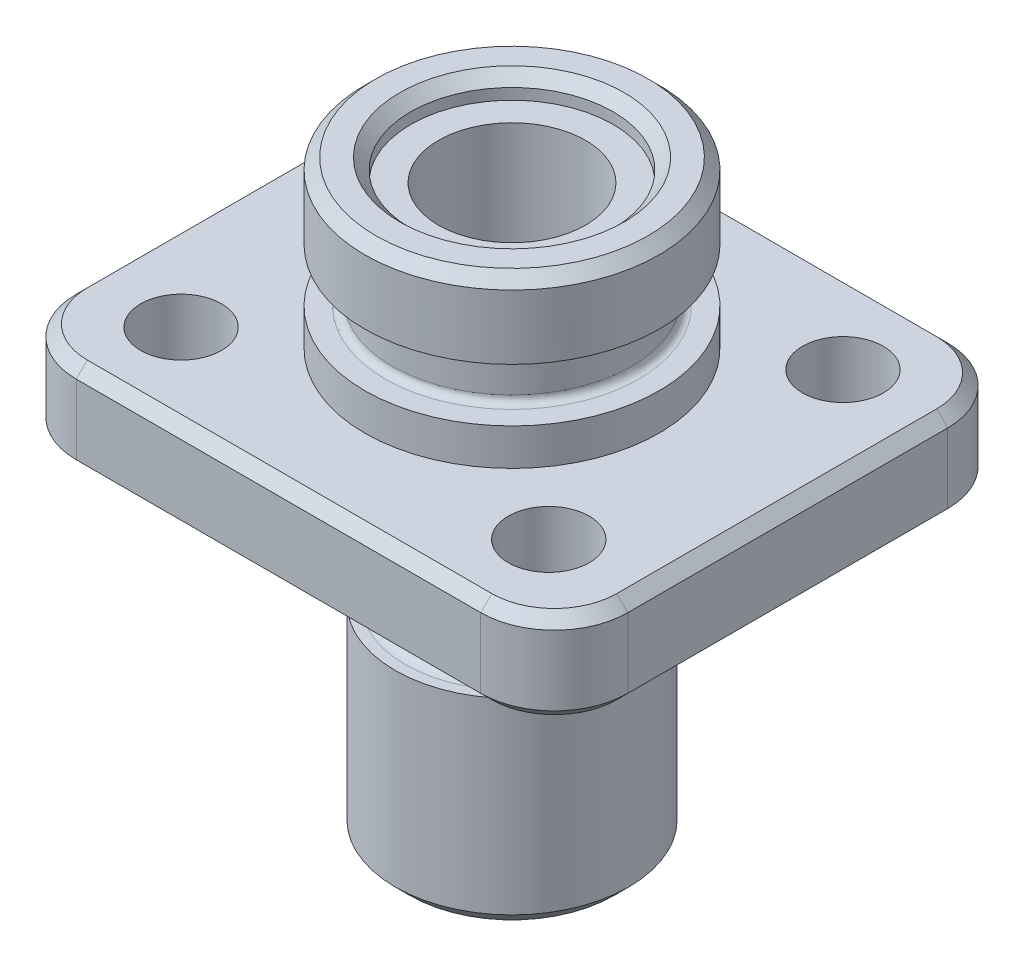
SolidWorks part; units mm, degrees
ref_plane "前视基准面" through (0, 0, 0) normal (0, 0, 1) x (1, 0, 0)
ref_plane "上视基准面" through (0, 0, 0) normal (0, 1, 0) x (1, 0, 0)
ref_plane "右视基准面" through (0, 0, 0) normal (1, 0, 0) x (0, 0, -1)
sketch "草图1" plane through (0, 0, 0) normal (0, 1, 0) x (1, 0, 0)
  line L1 (-7.5, -6.35) -> (7.5, -6.35)
  line L2 (-7.5, -6.35) -> (-7.5, 6.35)
  line L3 (-7.5, 6.35) -> (7.5, 6.35)
  line L4 (7.5, -6.35) -> (7.5, 6.35)
  line L5 (-7.5, -6.35) -> (7.5, 6.35) construction
  line L6 (-7.5, 6.35) -> (7.5, -6.35) construction
  point P0 (0, 0)
  dimension "D1" = 12.7
  dimension "D2" = 15
extrude "凸台-拉伸1" add sketch "草图1" along normal blind 4.5
sketch "草图3" plane through (0, 0, 0) normal (0, 0, 1) x (1, 0, 0)
  line L0 (0, 11.7015) -> (0, -15.4245) construction
  line L1 (0, 13) -> (-5.45, 13)
  line L2 (-5.45, 13) -> (-5.45, 4.5)
  line L3 (-7.5, 4.5) -> (7.5, 4.5) construction
  line L4 (-3.5, 4.5) -> (-3.5, -5)
  line L6 (-3.5, -5) -> (-2.9, -5)
  line L7 (-3.175, -6.5) -> (-3.175, -11.6)
  line L8 (-2.775, -12) -> (0, -12)
  line L9 (0, -12) -> (0, 13)
  line L10 (-5.45, 4.5) -> (-3.5, 4.5)
  line L11 (-3.175, -6.5) -> (-2.9, -6.5)
  line L12 (-2.6, -6.2) -> (-2.6, -5.3)
  line L13 (-7.5, 0) -> (7.5, 0) construction
  line L14 (-3.175, -11.6) -> (-2.775, -12)
  arc A0 (-2.9, -6.5) -> (-2.6, -6.2) centre (-2.9, -6.2) ccw
  arc A1 (-2.9, -5) -> (-2.6, -5.3) centre (-2.9, -5.3) cw
  point P12 (-3.175, -12)
  point P21 (-2.6, -6.5)
  point P24 (-2.6, -5)
  dimension "D9" = 0.3
  dimension "D1" = 10.9
  dimension "D2" = 8.5
  dimension "D3" = 1.5
  dimension "D4" = 6.35
  dimension "D5" = 7
  dimension "D6" = 5.2
  dimension "D7" = 5.5
  dimension "D8" = 12
revolve "旋转1" add sketch "草图3" angle 360 about L0
sketch "草图4" plane through (0, 0, 0) normal (1, 0, 0) x (0, 0, -1)
  line L0 (0, 24.1986) -> (0, -29.035) construction
  line L1 (0, -12) -> (-2.3, -12)
  line L2 (-2.775, -12) -> (2.775, -12) construction
  line L3 (-2.3, -12) -> (-2.3, -9.8)
  line L4 (-2.3, -9.8) -> (-2, -9.8)
  line L5 (-2, -9.8) -> (-2, -3.4)
  line L6 (-2, -3.4) -> (-1.8, -3.4)
  line L7 (-1.8, -3.4) -> (-1.8, -0.5)
  line L8 (-1.8, -0.5) -> (-1.1, -0.5)
  line L9 (0, 13) -> (0, -12)
  line L11 (4, 13) -> (-4, 13) construction
  line L12 (-1.1, -0.5) -> (-1.1, 0.5)
  line L13 (-1.1, 0.5) -> (-2, 0.5)
  line L14 (-2, 1.5) -> (-2, 8.5)
  line L15 (-2, 8.5) -> (-3.5, 8.5)
  line L16 (-3.5, 8.5) -> (-3.5, 13)
  line L17 (-3.5, 13) -> (0, 13)
  line L19 (-2, 1.5) -> (-2, 0.5)
  point P25 (-3.5, 2.5)
  point P28 (-3.5, 0.5)
  dimension "D1" = 4.6
  dimension "D2" = 4
  dimension "D3" = 2.2
  dimension "D4" = 6.4
  dimension "D5" = 3.6
  dimension "D6" = 13.5
  dimension "D7" = 1
  dimension "D8" = 2.2
  dimension "D9" = 2
  dimension "D10" = 3.5
revolve "切除-旋转1" cut sketch "草图4" angle 360 about L0
sketch "草图5" plane through (0, 0, 0) normal (0, -1, 0) x (1, 0, 0)
  line L0 (0, 11.0523) -> (0, -12.7303) construction
  line L1 (-14.2258, 0) -> (15.1051, 0) construction
  line L4 (-7.5, 6.35) -> (7.5, 6.35) construction
  line L5 (-7.5, -6.35) -> (-7.5, 6.35) construction
  point P5 (-3.5, 2.35)
  point P10 (3.5, 2.35)
  point P11 (3.5, -2.35)
  point P12 (-3.5, -2.35)
  dimension "D1" = 4
  dimension "D2" = 4
fillet "圆角1" radius 2 4 edges at (-7.5, 2.25, 6.35) (7.5, 2.25, 6.35) (7.5, 2.25, -6.35) (-7.5, 2.25, -6.35)
chamfer "倒角1" distance 0.3 angle 45 1 edges at (0, -5, 3.5)
chamfer "倒角4" distance 0.5 angle 45 1 edges at (0, 0.5, 1.1)
sketch "草图15" plane through (0, 4.5, 0) normal (0, 1, 0) x (1, 0, 0)
  line L4 (-7.5, 4.35) -> (-7.5, -4.35)
  line L5 (-5.5, -6.35) -> (5.5, -6.35)
  line L6 (7.5, -4.35) -> (7.5, 4.35)
  line L7 (5.5, 6.35) -> (-5.5, 6.35)
  line L8 (-7.5, 4.35) -> (-7.5, -4.35)
  line L9 (-5.5, -6.35) -> (5.5, -6.35)
  line L10 (7.5, -4.35) -> (7.5, 4.35)
  line L11 (5.5, 6.35) -> (-5.5, 6.35)
  circle A0 centre (0, 0) radius 4 construction
  circle A1 centre (0, 0) radius 4
  arc A4 (-7.5, -4.35) -> (-5.5, -6.35) centre (-5.5, -4.35) ccw
  arc A5 (5.5, -6.35) -> (7.5, -4.35) centre (5.5, -4.35) ccw
  arc A6 (7.5, 4.35) -> (5.5, 6.35) centre (5.5, 4.35) ccw
  arc A7 (-5.5, 6.35) -> (-7.5, 4.35) centre (-5.5, 4.35) ccw
  arc A8 (-7.5, -4.35) -> (-5.5, -6.35) centre (-5.5, -4.35) ccw
  arc A9 (5.5, -6.35) -> (7.5, -4.35) centre (5.5, -4.35) ccw
  arc A10 (7.5, 4.35) -> (5.5, 6.35) centre (5.5, 4.35) ccw
  arc A11 (-5.5, 6.35) -> (-7.5, 4.35) centre (-5.5, 4.35) ccw
  dimension "D1" = 0
extrude "切除-拉伸3" cut sketch "草图15" against normal blind 2
sketch "草图16" plane through (0, 13, 0) normal (0, 1, 0) x (1, 0, 0)
  circle A1 centre (0, 0) radius 4
  circle A2 centre (0, 0) radius 4
  dimension "D1" = 0
extrude "切除-拉伸4" cut sketch "草图16" against normal blind 7
sketch "草图17" plane through (0, 0, 0) normal (0, -1, 0) x (1, 0, 0)
  line L4 (5.5, 6.35) -> (-5.5, 6.35)
  line L5 (-7.5, 4.35) -> (-7.5, -4.35)
  line L6 (-5.5, -6.35) -> (5.5, -6.35)
  line L7 (7.5, -4.35) -> (7.5, 4.35)
  line L8 (5.5, 6.35) -> (-5.5, 6.35)
  line L9 (-7.5, 4.35) -> (-7.5, -4.35)
  line L10 (-5.5, -6.35) -> (5.5, -6.35)
  line L11 (7.5, -4.35) -> (7.5, 4.35)
  circle A0 centre (0, 0) radius 3.5 construction
  circle A1 centre (0, 0) radius 3.5
  arc A4 (-5.5, 6.35) -> (-7.5, 4.35) centre (-5.5, 4.35) ccw
  arc A5 (-7.5, -4.35) -> (-5.5, -6.35) centre (-5.5, -4.35) ccw
  arc A6 (5.5, -6.35) -> (7.5, -4.35) centre (5.5, -4.35) ccw
  arc A7 (7.5, 4.35) -> (5.5, 6.35) centre (5.5, 4.35) ccw
  arc A8 (-5.5, 6.35) -> (-7.5, 4.35) centre (-5.5, 4.35) ccw
  arc A9 (-7.5, -4.35) -> (-5.5, -6.35) centre (-5.5, -4.35) ccw
  arc A10 (5.5, -6.35) -> (7.5, -4.35) centre (5.5, -4.35) ccw
  arc A11 (7.5, 4.35) -> (5.5, 6.35) centre (5.5, 4.35) ccw
  dimension "D1" = 0
extrude "凸台-拉伸2" add sketch "草图17" along normal blind 3
sketch "草图18" plane through (0, 2.5, 0) normal (0, 1, 0) x (1, 0, 0)
  line L4 (-7.5, 4.35) -> (-7.5, -4.35)
  line L5 (-5.5, -6.35) -> (5.5, -6.35)
  line L6 (7.5, -4.35) -> (7.5, 4.35)
  line L7 (5.5, 6.35) -> (-5.5, 6.35)
  line L8 (-7.5, 4.35) -> (-7.5, -4.35)
  line L9 (-5.5, -6.35) -> (5.5, -6.35)
  line L10 (7.5, -4.35) -> (7.5, 4.35)
  line L11 (5.5, 6.35) -> (-5.5, 6.35)
  circle A0 centre (0, 0) radius 4 construction
  circle A1 centre (0, 0) radius 4
  arc A4 (-5.5, 6.35) -> (-7.5, 4.35) centre (-5.5, 4.35) ccw
  arc A5 (-7.5, -4.35) -> (-5.5, -6.35) centre (-5.5, -4.35) ccw
  arc A6 (5.5, -6.35) -> (7.5, -4.35) centre (5.5, -4.35) ccw
  arc A7 (7.5, 4.35) -> (5.5, 6.35) centre (5.5, 4.35) ccw
  arc A8 (-5.5, 6.35) -> (-7.5, 4.35) centre (-5.5, 4.35) ccw
  arc A9 (-7.5, -4.35) -> (-5.5, -6.35) centre (-5.5, -4.35) ccw
  arc A10 (5.5, -6.35) -> (7.5, -4.35) centre (5.5, -4.35) ccw
  arc A11 (7.5, 4.35) -> (5.5, 6.35) centre (5.5, 4.35) ccw
  dimension "D1" = 0
extrude "切除-拉伸5" cut sketch "草图18" against normal blind 3
sketch "草图20" plane through (0, 0, 0) normal (1, 0, 0) x (0, 0, -1)
  line L0 (0, 6) -> (0, -14.3965) construction
  line L1 (4, 6) -> (-4, 6) construction
  line L2 (-4.35, -0.5) -> (4.35, -0.5) construction
  line L3 (4.5668, 1.95) -> (3.25, 1.95)
  line L4 (4.5668, 1.95) -> (4.5668, 0.5)
  line L5 (4.5668, 0.5) -> (3.25, 0.5)
  line L6 (3.25, 1.95) -> (3.25, 0.5)
  dimension "D1" = 3.25
  dimension "D2" = 1
  dimension "D3" = 1.45
revolve "切除-旋转2" cut sketch "草图20" angle 360 about L0
fillet "圆角2" radius 0.2 2 edges at (0, 1.95, 3.25) (0, 0.5, 3.25)
sketch "草图21" plane through (0, 6, 0) normal (0, 1, 0) x (1, 0, 0)
  circle A1 centre (0, 0) radius 4
  circle A2 centre (0, 0) radius 4
  dimension "D1" = 0
extrude "切除-拉伸6" cut sketch "草图21" against normal blind 2
sketch "草图22" plane through (0, 4, 0) normal (0, 1, 0) x (1, 0, 0)
  circle A0 centre (0, 0) radius 2.75
  dimension "D1" = 5.5
extrude "切除-拉伸7" cut sketch "草图22" against normal blind 0.6
chamfer "倒角5" distance 0.3 angle 45 18 edges at (0, -0.5, 6.35) (6.9142, -0.5, 5.7642) (-6.9142, -0.5, 5.7642) (7.5, -0.5, 0) (-7.5, -0.5, 0) (6.9142, -0.5, -5.7642) (-6.9142, -0.5, -5.7642) (0, -0.5, -6.35) (0, -3, 6.35) (-6.9142, -3, 5.7642) (6.9142, -3, 5.7642) (-7.5, -3, 0) (7.5, -3, 0) (-6.9142, -3, -5.7642) (6.9142, -3, -5.7642) (0, -3, -6.35) (0, 4, 4) (0, 4, 2.75)
sketch "草图23" plane through (0, -3, 0) normal (0, -1, 0) x (1, 0, 0)
  circle A0 centre (-5, 4) radius 1.1 construction
  circle A1 centre (5, 4) radius 1.1 construction
  circle A2 centre (-5, -4) radius 1.1 construction
  circle A3 centre (5, -4) radius 1.1 construction
  circle A4 centre (-5, 4) radius 1.1
  circle A5 centre (5, 4) radius 1.1
  circle A6 centre (-5, -4) radius 1.1
  circle A7 centre (5, -4) radius 1.1
extrude "切除-拉伸8" cut sketch "草图23" against normal blind 10
chamfer "倒角6" distance 0.3 angle 45 4 edges at (-5, -3, 2.9) (5, -3, 2.9) (5, -3, -5.1) (-5, -3, -5.1)
